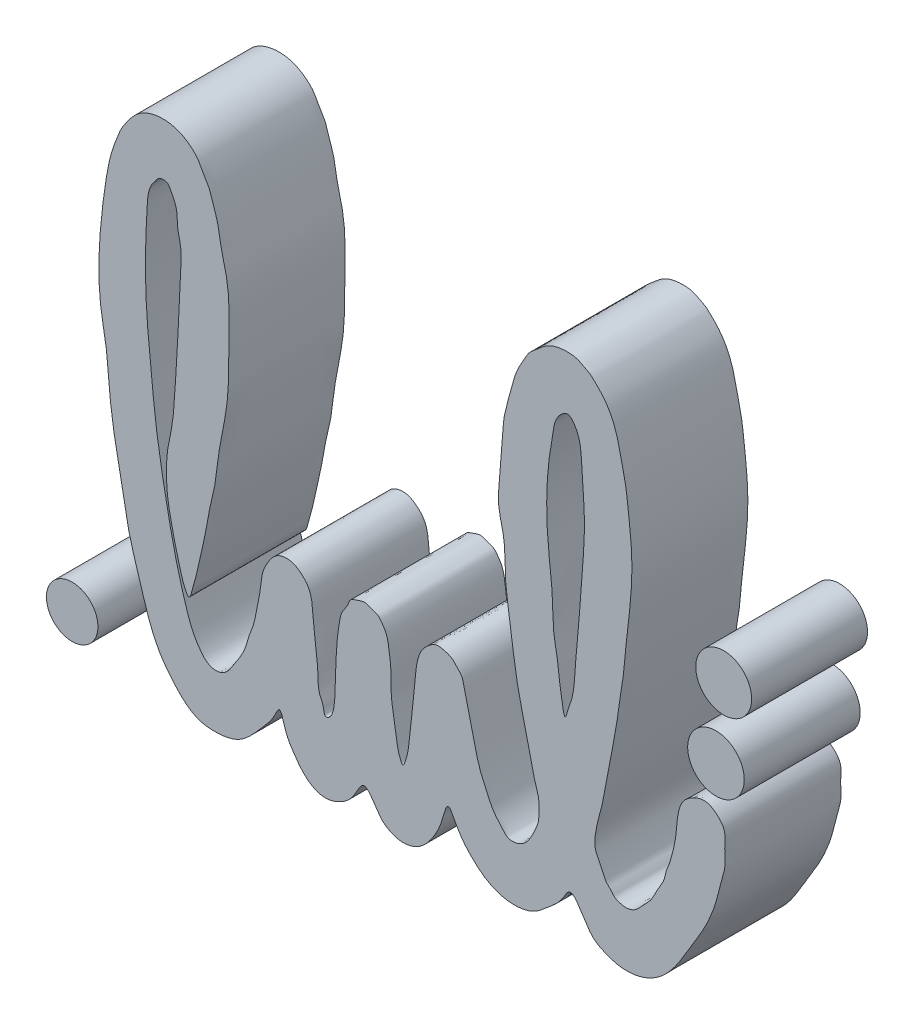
SolidWorks part; units mm, degrees
ref_plane "Front Plane" through (0, 0, 0) normal (0, 0, 1) x (1, 0, 0)
ref_plane "Top Plane" through (0, 0, 0) normal (0, 1, 0) x (1, 0, 0)
ref_plane "Right Plane" through (0, 0, 0) normal (1, 0, 0) x (0, 0, -1)
sketch "Sketch1" plane through (0, 0, 0) normal (0, 0, 1) x (1, 0, 0)
  circle A0 centre (5.6009, 0.7963) radius 0.4814
  circle A1 centre (5.4678, -0.4752) radius 0.4879
  circle A2 centre (-5.638, -3.7631) radius 0.4443
  spline S0 degree 3 number of poles 267 (5.0878, -1.1795) -> (5.0878, -1.1795)
  spline S1 degree 3 poles (2.9051, -0.9716) (3.0189, -0.6836) (3.0204, -0.4035) (3.1069, 0.4612) (3.1522, 1.1693) (3.2289, 1.9783) (3.1487, 2.7422) (3.1342, 3.2461) (2.9131, 3.5132) (2.6774, 3.3109) (2.6567, 3.0246) (2.5828, 2.639) (2.5349, 2.0741) (2.5568, 1.3628) (2.66, 0.6514) (2.6502, 0.0979) (2.7376, -0.2678) (2.7722, -0.6537) (2.7885, -0.6843) (2.8576, -1.1965) (2.9051, -0.9716) (3.0189, -0.6836) (3.0204, -0.4035) knots -0.023587 -0.008408 -0.000841 0 0.074379 0.155616 0.222268 0.32297 0.415894 0.473834 0.490169 0.510583 0.552191 0.585468 0.638853 0.738106 0.817477 0.876243 0.91442 0.949593 0.976413 0.991592 0.999159 1 1.074379 1.155616 1.222268 only from (2.9178, -0.9394) to (2.9178, -0.9394)
extrude "Boss-Extrude1" add sketch "Sketch1" along normal blind 2
scale "Scale1" bodies to scale 102 104 103 101 scale about origin uniform scaling yes scale factor 1.8
ref_plane "Plane1" through (0, 0, 3.6) normal (0, 0, 1) x (1, 0, 0)
sketch "Sketch2" plane through (0, 0, 3.6) normal (0, 0, 1) x (1, 0, 0)
  line L1 (-7.0075, 5.5297) -> (6.9449, 5.5297)
  line L2 (-7.0075, 5.5297) -> (-7.0075, -6.0883)
  line L3 (-7.0075, -6.0883) -> (6.9449, -6.0883)
  line L4 (6.9449, 5.5297) -> (6.9449, -6.0883)
